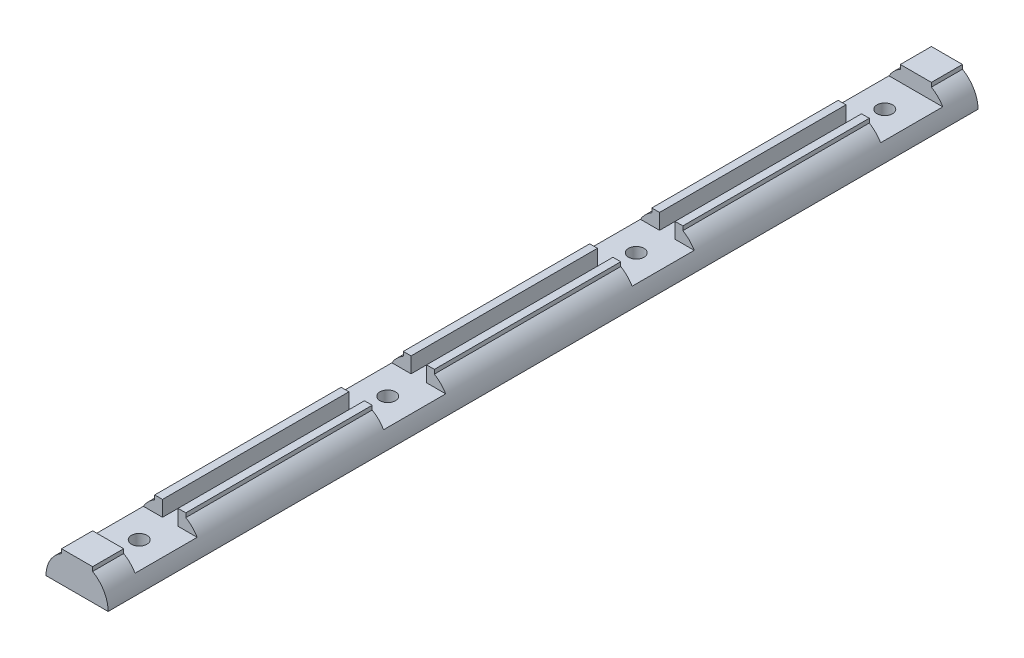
SolidWorks part; units mm, degrees
ref_plane "Front Plane" through (0, 0, 0) normal (0, 0, 1) x (1, 0, 0)
ref_plane "Top Plane" through (0, 0, 0) normal (0, 1, 0) x (1, 0, 0)
ref_plane "Right Plane" through (0, 0, 0) normal (1, 0, 0) x (0, 0, -1)
sketch "Sketch1" plane through (0, 0, 0) normal (0, 0, 1) x (1, 0, 0)
  circle A0 centre (0, 0) radius 10
  dimension "D1" = 20
extrude "Boss-Extrude1" add sketch "Sketch1" along normal mid plane 280
sketch "Sketch2" plane through (0, 0, 140) normal (0, 0, 1) x (1, 0, 0)
  line L1 (5, -10) -> (-5, -10)
  line L2 (5, -10) -> (5, 10)
  line L3 (5, 10) -> (-5, 10)
  line L4 (-5, -10) -> (-5, 10)
  line L5 (5, -10) -> (-5, 10) construction
  line L6 (5, 10) -> (-5, -10) construction
  circle A0 centre (0, 0) radius 10 construction
  point P0 (0, 0)
  dimension "D2" = 10
extrude "Boss-Extrude2" add sketch "Sketch2" against normal up to surface (280 mm away)
ref_plane "Plane1" through (0, 0, -120) normal (0, 0, -1) x (-1, 0, 0)
sketch "Sketch3" plane through (0, 0, -120) normal (0, 0, 1) x (1, 0, 0)
  line L1 (8.6603, 5) -> (-8.6603, 5)
  line L2 (8.6603, 5) -> (8.6603, 10)
  line L3 (8.6603, 10) -> (-8.6603, 10)
  line L4 (-8.6603, 5) -> (-8.6603, 10)
  line L5 (8.6603, 5) -> (-8.6603, 10) construction
  line L6 (8.6603, 10) -> (-8.6603, 5) construction
  circle A0 centre (0, 0) radius 10 construction
  point P0 (0, 7.5)
  dimension "D1" = 5
extrude "Cut-Extrude1" cut sketch "Sketch3" against normal mid plane 20
sketch "Sketch4" plane through (0, 5, 0) normal (0, 1, 0) x (1, 0, 0)
  line L0 (-8.6603, 130) -> (8.6603, 110) construction
  circle A0 centre (0, 120) radius 2.5
  dimension "D1" = 5
extrude "Cut-Extrude3" cut sketch "Sketch4" against normal through all
sketch "Sketch5" plane through (0, 10, 0) normal (0, 1, 0) x (1, 0, 0)
  line L0 (-8.6603, 110) -> (8.6603, 110) construction
  line L1 (2.5, -110) -> (-2.5, -110)
  line L2 (2.5, -110) -> (2.5, 110)
  line L3 (2.5, 110) -> (-2.5, 110)
  line L4 (-2.5, -110) -> (-2.5, 110)
  line L5 (2.5, -110) -> (-2.5, 110) construction
  line L6 (2.5, 110) -> (-2.5, -110) construction
  point P0 (0, 0)
  dimension "D1" = 5
extrude "Cut-Extrude2" cut sketch "Sketch5" against normal up to surface (5 mm away)
pattern_linear "LPattern1" count 4 spacing 80 along (0, 0, 1) of "Cut-Extrude1", "Cut-Extrude3"
sketch "Sketch6" plane through (0, 0, 140) normal (0, 0, 1) x (1, 0, 0)
  line L0 (-5, -10) -> (5, -10) construction
  line L1 (10, -10) -> (-10, -10)
  line L2 (10, -10) -> (10, 0)
  line L3 (10, 0) -> (-10, 0)
  line L4 (-10, -10) -> (-10, 0)
  line L5 (10, -10) -> (-10, 0) construction
  line L6 (10, 0) -> (-10, -10) construction
  arc A0 (-5, 8.6603) -> (-5, -8.6603) centre (0, 0) ccw construction
  point P0 (0, -5)
extrude "Cut-Extrude4" cut sketch "Sketch6" against normal through all
